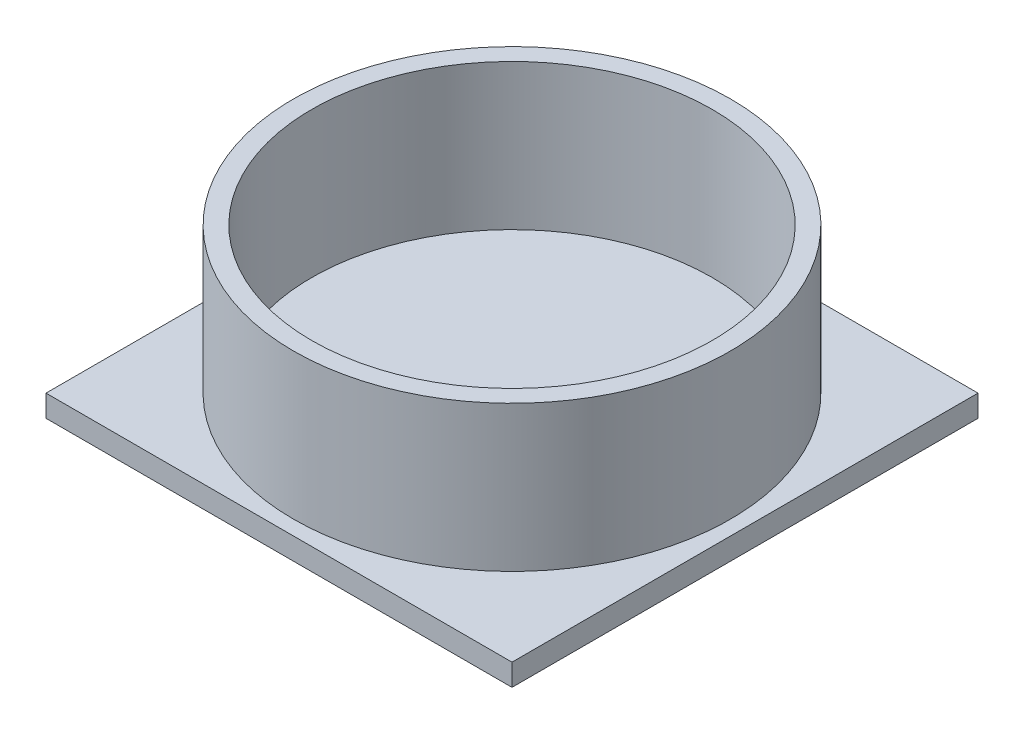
SolidWorks part; units mm, degrees
ref_plane "Front Plane" through (0, 0, 0) normal (0, 0, 1) x (1, 0, 0)
ref_plane "Top Plane" through (0, 0, 0) normal (0, 1, 0) x (1, 0, 0)
ref_plane "Right Plane" through (0, 0, 0) normal (1, 0, 0) x (0, 0, -1)
sketch "Sketch1" plane through (0, 0, 0) normal (0, 1, 0) x (1, 0, 0)
  circle A0 centre (0, 0) radius 300
  circle A1 centre (0, 0) radius 275
extrude "Boss-Extrude1" add sketch "Sketch1" along normal blind 200
sketch "Sketch2" plane through (0, 0, 0) normal (0, 1, 0) x (1, 0, 0)
  line L1 (-320, -320) -> (320, -320)
  line L2 (-320, -320) -> (-320, 320)
  line L3 (-320, 320) -> (320, 320)
  line L4 (320, -320) -> (320, 320)
  dimension "D1" = 320
  dimension "D2" = 320
  dimension "D3" = 320
  dimension "D4" = 320
extrude "Boss-Extrude2" add sketch "Sketch2" against normal blind 30
